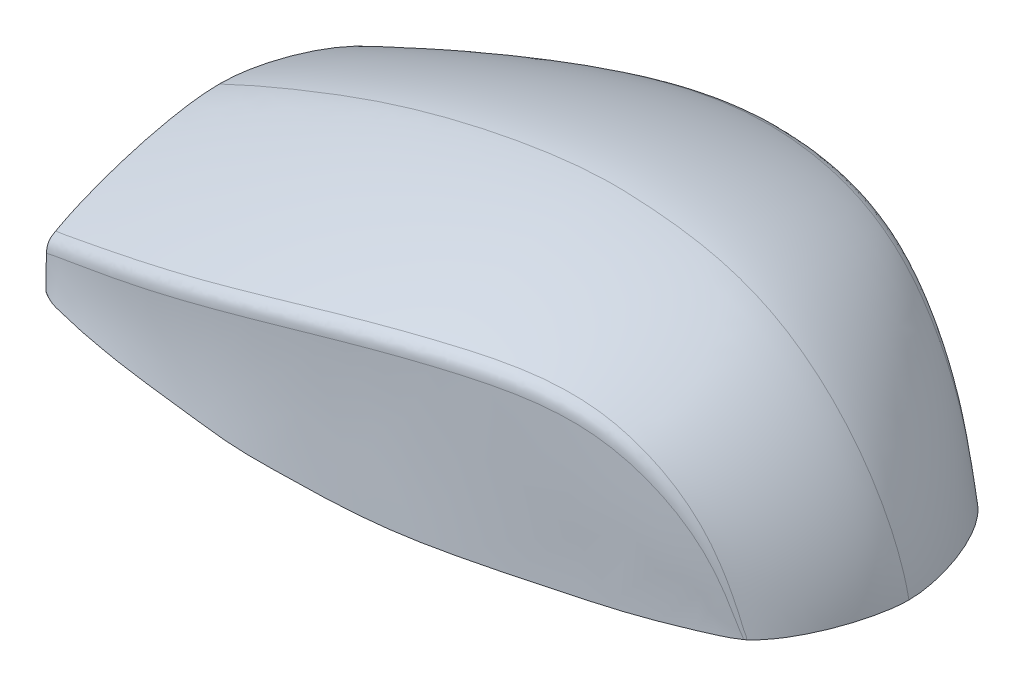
SolidWorks part; units mm, degrees
ref_plane "Front Plane" through (0, 0, 0) normal (0, 0, 1) x (1, 0, 0)
ref_plane "Top Plane" through (0, 0, 0) normal (0, 1, 0) x (1, 0, 0)
ref_plane "Right Plane" through (0, 0, 0) normal (1, 0, 0) x (0, 0, -1)
imported_body "Surface-Imported1"
sketch "123"
sketch3d "3DSketch1"
  line L0 (7.6047, 7.5812, 28.0116) -> (7.6047, 0, 27.6143)
  line L1 (7.6047, 7.5812, 28.0116) -> (7.6047, -1.3964, 28.0116) construction
  dimension "D1" = 3
sketch3d "3DSketch2"
  spline S0 degree 3 poles (2737.9969, 1100.7057, -926.9214) (49.6921, -172.2056, 39.3054) (139.6424, -53.8438, 11.2845) (113.3744, 9.8845, 20.8988) (112.1801, 12.2149, 21.3281) (109.1762, 16.5735, 22.3687) (107.4518, 18.5364, 22.9496) (103.5698, 21.9988, 24.2023) (101.3953, 23.4966, 24.8788) (98.4548, 24.9227, 25.7472) (97.2765, 25.4321, 26.0905) (94.8357, 26.271, 26.7829) (92.9747, 26.696, 27.2893) (89.1418, 27.338, 28.2981) (84.4968, 27.5741, 29.4423) (79.2396, 27.2401, 30.5385) (75.5765, 26.8711, 31.2105) (72.4391, 26.4893, 31.737) (64.6432, 25.2679, 32.8416) (57.9342, 23.6607, 33.3124) (50.7367, 21.6689, 33.437) (45.6047, 20.1766, 33.4211) (40.5305, 18.5757, 33.1522) (34.6253, 16.6856, 32.6723) (29.604, 15.0456, 32.1227) (24.6195, 13.3766, 31.3484) (19.742, 11.7314, 30.4999) (15.4061, 10.2555, 29.6555) (-114.3371, -34.2039, 2.4211) (-239.0189, -79.2212, -39.5956) (-823.8072, 180.7078, 2888.3587) knots -1.516447 -1.516447 -1.516447 -1.516447 0.0625 0.0625 0.125 0.125 0.1875 0.1875 0.25 0.25 0.267079 0.28125 0.3125 0.3125 0.375 0.42477 0.4375 0.462538 0.5 0.625 0.625 0.674433 0.75 0.75 0.820707 0.875 0.875 0.943359 0.984375 4.155292 4.155292 4.155292 4.155292 only from (117.013, 0, 19.5457) to (7.6047, 7.5812, 28.0116) construction
  spline S1 degree 3 poles (117.013, 0, 19.5457) (116.1944, 2.5155, 19.859) (115.3747, 5.0314, 20.1667) (113.3744, 9.8845, 20.8988) (112.1801, 12.2149, 21.3281) (109.1762, 16.5735, 22.3687) (107.4518, 18.5364, 22.9496) (103.5698, 21.9988, 24.2023) (101.3953, 23.4966, 24.8788) (98.4548, 24.9227, 25.7472) (97.2765, 25.4321, 26.0905) (94.8357, 26.271, 26.7829) (92.9747, 26.696, 27.2893) (89.1418, 27.338, 28.2981) (84.4968, 27.5741, 29.4423) (79.2396, 27.2401, 30.5385) (75.5765, 26.8711, 31.2105) (72.4391, 26.4893, 31.737) (64.6432, 25.2679, 32.8416) (57.9342, 23.6607, 33.3124) (50.7367, 21.6689, 33.437) (45.6047, 20.1766, 33.4211) (40.5305, 18.5757, 33.1522) (34.6253, 16.6856, 32.6723) (29.604, 15.0456, 32.1227) (24.6195, 13.3766, 31.3484) (19.742, 11.7314, 30.4999) (15.4061, 10.2555, 29.6555) (10.4621, 8.5613, 28.6177) (8.2225, 7.7931, 28.1427) (7.6047, 7.5812, 28.0116) knots 0 0 0 0 0.0625 0.0625 0.125 0.125 0.1875 0.1875 0.25 0.25 0.267079 0.28125 0.3125 0.3125 0.375 0.42477 0.4375 0.462538 0.5 0.625 0.625 0.674433 0.75 0.75 0.820707 0.875 0.875 0.943359 0.984375 1 1 1 1
sketch "Sketch1" plane through (0, 0, 0) normal (0, 1, 0) x (1, 0, 0)
  line L0 (0, 0) -> (185.3733, 0)
  spline S0 degree 3 poles (1.5462, 0) (1.6773, -4.305) (2.2732, -10.6466) (4.2164, -18.2565) (5.063, -21.9328) (6.692, -25.8457) (7.4936, -28.0246) (9.8722, -28.8633) (14.5744, -30.0741) (17.9422, -30.7361) (26.0145, -32.2556) (35.9692, -33.2273) (45.2285, -34.5024) (56.0828, -34.375) (68.9485, -34.1273) (82.803, -31.1847) (94.9849, -27.9396) (104.3133, -25.3413) (112.5745, -21.9262) (117.168, -19.7896) (119.5519, -17.016) (123.0982, -10.2033) (124.805, -4.7725) (125.0975, 0) knots 0 0 0 0 0.084126 0.113087 0.142999 0.160558 0.175405 0.197005 0.208328 0.235481 0.282574 0.361232 0.418305 0.459973 0.567244 0.642619 0.725419 0.795114 0.834761 0.863902 0.890371 0.915209 1 1 1 1
sketch "Sketch2" plane through (0, 0, 0) normal (0, 1, 0) x (1, 0, 0)
  spline S1 degree 3 poles (-211.6221, -977.0013) (63.0596, 131.1795) (-11.1507, 41.9228) (4.2164, -18.2565) (5.063, -21.9328) (6.692, -25.8457) (7.4936, -28.0246) (9.8722, -28.8633) (14.5744, -30.0741) (17.9422, -30.7361) (26.0145, -32.2556) (35.9692, -33.2273) (45.2285, -34.5024) (56.0828, -34.375) (68.9485, -34.1273) (82.803, -31.1847) (94.9849, -27.9396) (104.3133, -25.3413) (112.5745, -21.9262) (117.168, -19.7896) (119.5519, -17.016) (144.2045, 30.3439) (87.2607, 72.3644) (-444.1685, 822.1365) knots -0.987848 -0.987848 -0.987848 -0.987848 0.084126 0.113087 0.142999 0.160558 0.175405 0.197005 0.208328 0.235481 0.282574 0.361232 0.418305 0.459973 0.567244 0.642619 0.725419 0.795114 0.834761 0.863902 0.890371 0.915209 1.810014 1.810014 1.810014 1.810014 only from (1.5462, 0) to (125.0975, 0) construction
  spline S3 degree 3 poles (7.6047, -27.6143) (8.2329, -28.2853) (9.8722, -28.8633) (14.5744, -30.0741) (17.9422, -30.7361) (26.0145, -32.2556) (35.9692, -33.2273) (45.2285, -34.5024) (56.0828, -34.375) (68.9485, -34.1273) (82.803, -31.1847) (94.9849, -27.9396) (104.3133, -25.3413) (112.5745, -21.9262) (115.8916, -20.3833) (117.013, -19.5457) knots 0.175405 0.175405 0.175405 0.175405 0.197005 0.208328 0.235481 0.282574 0.361232 0.418305 0.459973 0.567244 0.642619 0.725419 0.795114 0.834761 0.863902 0.863902 0.863902 0.863902
  point P2 (6.1585, -29.7716)
  point P5 (117.013, -19.5457)
surface "Surface-Fill2"
surface "Surface-Trim1"
fillet "Fillet2" radius 3 3 edges
sketch "Sketch4" plane through (0, 0, 0) normal (0, 1, 0) x (1, 0, 0)
  line L0 (7.6047, -27.6143) -> (7.6047, 10.1581)
ref_plane "Plane1" through (7.547, -0.6603, 0) normal (0.9962, -0.0872, 0) x (0, 0, -1)
surface "Surface-Trim2"
mirror "Mirror1" about plane through (0, 0, 0) normal (0, 0, 1)
sketch3d "3DSketch3"
  spline S0 degree 1 poles (7.6055, -0.0013, -27.6254) (7.6055, -0.0013, 27.6254) knots 0 0 1 1
surface "Surface-Fill3"
surface "Surface-Fill5"
surface "Surface-Knit1"
